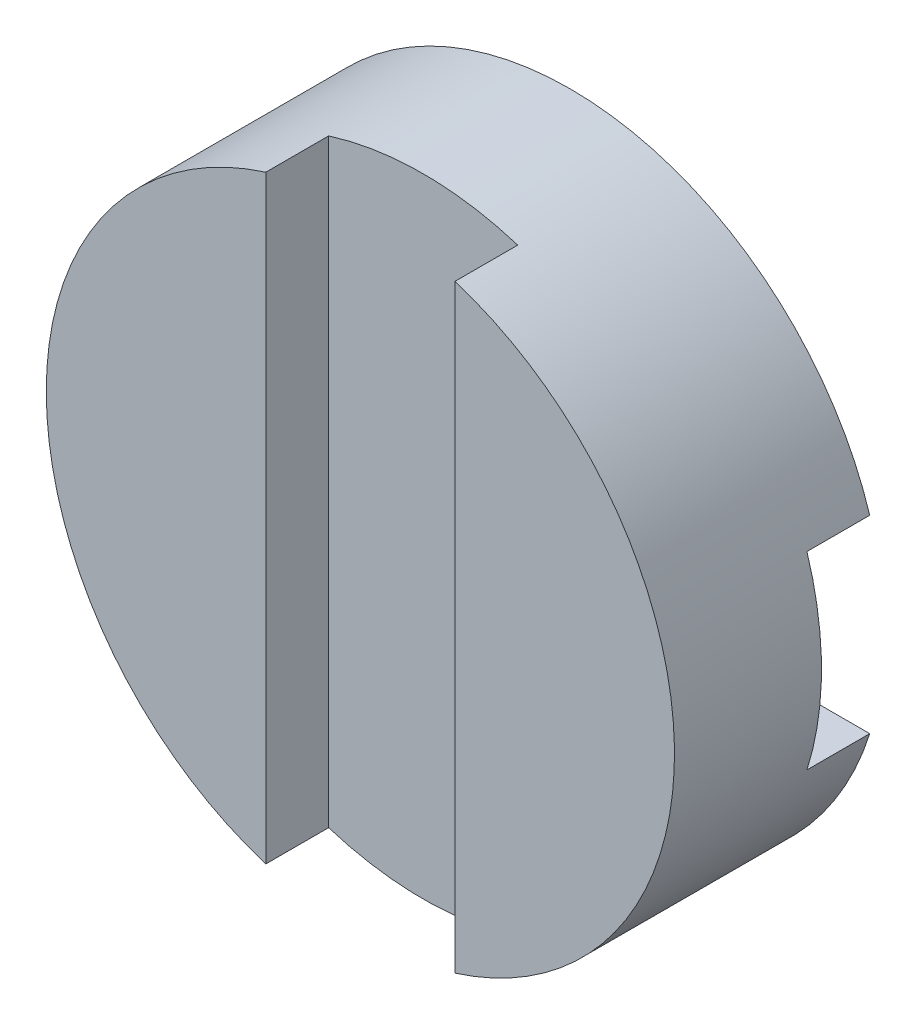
SolidWorks part; units mm, degrees
ref_plane "Front" through (0, 0, 0) normal (0, 0, 1) x (1, 0, 0)
ref_plane "Top" through (0, 0, 0) normal (0, 1, 0) x (1, 0, 0)
ref_plane "Right" through (0, 0, 0) normal (1, 0, 0) x (0, 0, -1)
sketch "Sketch1" plane through (0, 0, 0) normal (0, 0, 1) x (1, 0, 0)
  circle A0 centre (0, 0) radius 6.35
  point P3 (0, 6.35)
extrude "Boss-Extrude1" add sketch "Sketch1" against normal mid plane 4.2418
sketch "Sketch2" plane through (0, 0, 2.1209) normal (0, 0, 1) x (1, 0, 0)
  line L0 (-1.9114, 6.35) -> (1.9114, -6.35) construction
  line L1 (-1.9114, 6.35) -> (1.9114, 6.35)
  line L2 (-1.9114, 6.35) -> (-1.9113, -6.35)
  line L3 (-1.9113, -6.35) -> (1.9114, -6.35)
  line L4 (1.9114, 6.35) -> (1.9114, -6.35)
  circle A0 centre (0, 0) radius 6.35 construction
extrude "Cut-Extrude1" cut sketch "Sketch2" against normal blind 1.27
sketch "Sketch3" plane through (0, 0, -2.1209) normal (0, 0, -1) x (-1, 0, 0)
  line L1 (-6.35, 1.9114) -> (6.35, 1.9114)
  line L2 (-6.35, 1.9114) -> (-6.35, -1.9114)
  line L3 (-6.35, -1.9114) -> (6.35, -1.9114)
  line L4 (6.35, 1.9114) -> (6.35, -1.9114)
  line L14 (1.9114, 6.35) -> (-1.9114, 6.35) construction
  line L15 (6.35, 1.9114) -> (-6.35, -1.9114) construction
  circle A0 centre (0, 0) radius 6.35 construction
extrude "Cut-Extrude2" cut sketch "Sketch3" against normal blind 1.27
sketch "Sketch4" [suppressed] plane through (0, 0, 7.0485) normal (0, 0, 1) x (1, 0, 0)
  line L0 (-6.2675, 0) -> (-10.0775, 0) construction
  line L1 (20.6375, 20.6375) -> (10.0775, 20.6375)
  line L2 (20.6375, 20.6375) -> (20.6375, -20.6375)
  line L3 (20.6375, -20.6375) -> (10.0775, -20.6375)
  line L4 (10.0775, 20.6375) -> (10.0775, -20.6375)
  line L5 (-20.6375, 20.6375) -> (-10.0775, 20.6375)
  line L6 (-20.6375, 20.6375) -> (-20.6375, -20.6375)
  line L7 (-20.6375, -20.6375) -> (-10.0775, -20.6375)
  line L8 (-10.0775, 20.6375) -> (-10.0775, -20.6375)
  line L9 (-6.2675, 19.6628) -> (-6.2675, -19.6628) construction
  line L10 (6.2674, 0) -> (10.0775, 0) construction
  line L11 (6.2674, -19.6628) -> (6.2675, 19.6628) construction
  line L12 (-6.2675, 20.6375) -> (6.2675, 20.6375) construction
  line L13 (-6.2675, -20.6375) -> (6.2674, -20.6375) construction
  line L14 (6.2675, 20.6375) -> (6.2675, -20.6375) construction
  circle A1 centre (0, 0) radius 20.6375 construction
extrude "Cut-Extrude3" [suppressed] cut sketch "Sketch4" against normal blind 0.508
sketch "Sketch5" [suppressed] plane through (0, 0, -7.0485) normal (0, 0, -1) x (-1, 0, 0)
  line L0 (-20.6375, 20.6375) -> (-10.0775, 20.6375) construction
  line L1 (-20.6375, 20.6375) -> (20.6375, 20.6375)
  line L2 (-20.6375, 20.6375) -> (-20.6375, 10.0775)
  line L3 (-20.6375, 10.0775) -> (20.6375, 10.0775)
  line L4 (20.6375, 20.6375) -> (20.6375, 10.0775)
  line L5 (20.6375, -20.6375) -> (-20.6375, -20.6375)
  line L6 (20.6375, -20.6375) -> (20.6375, -10.0775)
  line L7 (20.6375, -10.0775) -> (-20.6375, -10.0775)
  line L8 (-20.6375, -20.6375) -> (-20.6375, -10.0775)
  line L9 (0, 6.2675) -> (0, 10.0775) construction
  line L10 (-19.6628, 6.2675) -> (19.6628, 6.2675) construction
  line L11 (-20.6375, 6.2675) -> (-20.6375, -6.2674) construction
  line L12 (0, -10.0775) -> (0, -6.2674) construction
  line L13 (-19.6628, -6.2674) -> (19.6628, -6.2674) construction
  circle A0 centre (0, 0) radius 20.6375 construction
extrude "Cut-Extrude4" [suppressed] cut sketch "Sketch5" against normal blind 0.508
chamfer "Chamfer1" [suppressed] distance 5.016 angle 30
sketch "Sketch6" [suppressed] plane through (0, 0, 7.0485) normal (0, 0, 1) x (1, 0, 0)
  line L0 (-6.5808, 7.4811) -> (6.5808, -7.4811) construction
  line L1 (-6.5808, 7.4811) -> (6.5808, 7.4811)
  line L2 (-6.5808, 7.4811) -> (-6.5808, -7.4811)
  line L3 (-6.5808, -7.4811) -> (6.5808, -7.4811)
  line L4 (6.5808, 7.4811) -> (6.5808, -7.4811)
extrude "Cut-Extrude5" [suppressed] cut sketch "Sketch6" against normal up to surface (6.477 mm away)
sketch "Sketch7" [suppressed] plane through (0, 0, -7.0485) normal (0, 0, -1) x (-1, 0, 0)
  line L0 (-7.4811, 6.5808) -> (7.4811, -6.5808) construction
  line L1 (-7.4811, 6.5808) -> (7.4811, 6.5808)
  line L2 (-7.4811, 6.5808) -> (-7.4811, -6.5808)
  line L3 (-7.4811, -6.5808) -> (7.4811, -6.5808)
  line L4 (7.4811, 6.5808) -> (7.4811, -6.5808)
  line L5 (6.5808, 7.4811) -> (6.5808, -7.4811) construction
  line L6 (6.5808, 7.4811) -> (-6.5808, 7.4811) construction
extrude "Cut-Extrude6" [suppressed] cut sketch "Sketch7" against normal up to surface (6.477 mm away)
sketch "Sketch8" plane through (0, 0, 0) normal (1, 0, 0) x (0, 0, -1)
  line L0 (-2.1209, 6.0555) -> (-2.1209, -6.0555) construction
  line L2 (2.1209, 1.9114) -> (2.1209, 6.35) construction
  point P0 (2.1209, 6.35)
  point P1 (-2.1209, 6.35)
equation "\"D1@Cut-Extrude2\" = \"Tooth depth@Cut-Extrude1\""
equation "\"D1@Cut-Extrude4\" = \"Tooth depth 2@Cut-Extrude3\""
equation "\"D1@Chamfer1\" = \"D1@Sketch4\" * .475"
equation "\"D1@Sketch6\" = \"Tooth gap@Sketch2\" * 1.05"
equation "\"D2@Sketch6\" = \"OD@Sketch1\" * .3625"
